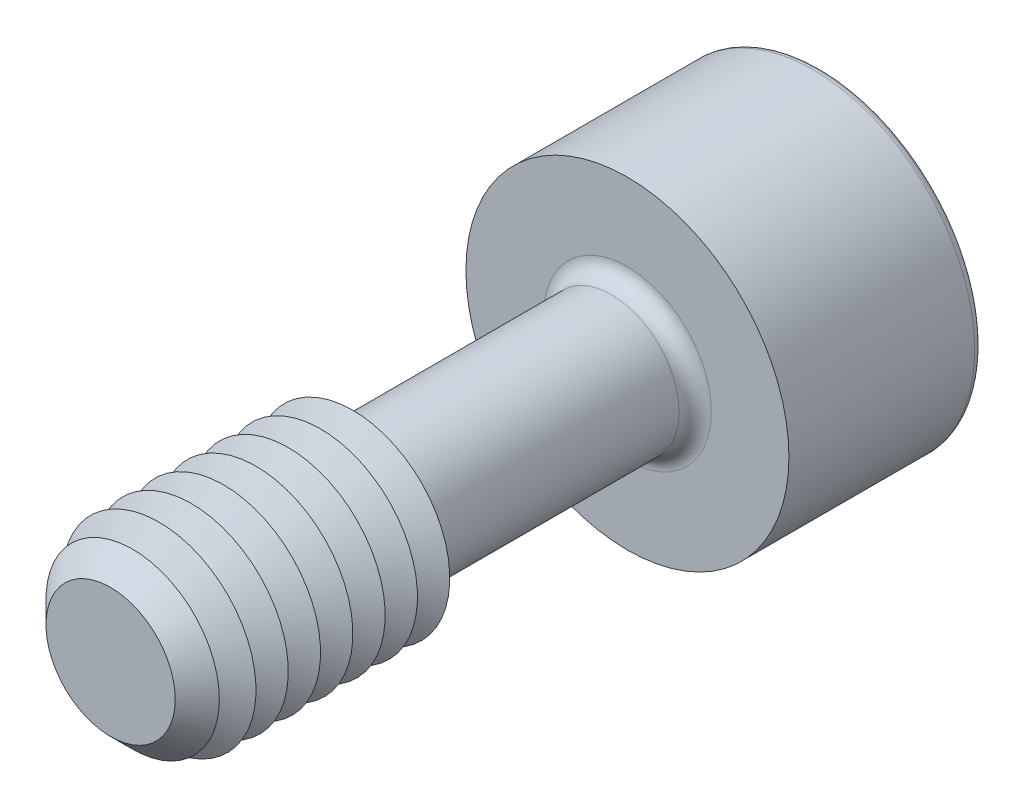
SolidWorks part; units mm, degrees
ref_plane "Front Plane" through (0, 0, 0) normal (0, 0, 1) x (1, 0, 0)
ref_plane "Top Plane" through (0, 0, 0) normal (0, 1, 0) x (1, 0, 0)
ref_plane "Right Plane" through (0, 0, 0) normal (1, 0, 0) x (0, 0, -1)
sketch "Sketch1" plane through (0, 0, 0) normal (0, 0, 1) x (1, 0, 0)
  circle A0 centre (0, 0) radius 2.1
  dimension "D1" = 4.2
extrude "Extrude1" add sketch "Sketch1" along normal mid plane 16
sketch "Sketch2" plane through (0, 0, 0) normal (1, 0, 0) x (0, 0, -1)
  line L0 (-8, 0) -> (-8, 3)
  line L1 (-8, 2.1) -> (-8, -2.1) construction
  line L2 (-8, 3) -> (-0.5, 3)
  line L3 (-0.5, 3) -> (0.0196, 2.1)
  line L4 (8, 2.1) -> (-8, 2.1) construction
  line L5 (0.0196, 2.1) -> (0.0196, 0)
  line L6 (0.0196, 0) -> (-8, 0)
  dimension "D1" = 3
  dimension "D2" = 120
  dimension "D3" = 7.5
revolve "Revolve1" add sketch "Sketch2" angle 360 about L6
chamfer "Chamfer1" distance 1 angle 45 1 edges at (0, 3, 8)
sketch "Sketch3" plane through (0, 0, -8) normal (0, 0, -1) x (-1, 0, 0)
  circle A0 centre (0, 0) radius 5
  dimension "D1" = 10
extrude "Extrude2" add sketch "Sketch3" along normal blind 6
sketch "Sketch4" plane through (-13.7, 0, -14) normal (0, 0, 1) x (1, 0, 0)
  line L2 (12.2566, -2.5) -> (15.1434, -2.5)
  line L3 (15.1434, -2.5) -> (16.5868, 0)
  line L4 (16.5868, 0) -> (15.1434, 2.5)
  line L6 (15.1434, 2.5) -> (12.2566, 2.5)
  line L7 (12.2566, 2.5) -> (10.8132, 0)
  line L8 (10.8132, 0) -> (12.2566, -2.5)
  circle A0 centre (13.7, 0) radius 2.5 construction
  dimension "D1" = 5
extrude "Extrude3" cut sketch "Sketch4" along normal blind 5
fillet "Fillet1" radius 0.5 1 edges at (-2.1, 0, -8)
fillet "Fillet2" radius 0.25 1 edges at (-5, 0, -14)
sketch "Sketch5" plane through (0, 0, 0) normal (1, 0, 0) x (0, 0, -1)
  line L0 (9, 0) -> (9, -2.5)
  line L1 (9, -2.5) -> (7.5566, 0)
  line L2 (7.5566, 0) -> (9, 0)
  dimension "D1" = 30
revolve "Cut-Revolve1" cut sketch "Sketch5" angle 360 about L2
sketch "Sketch6" plane through (0, 0, 0) normal (1, 0, 0) x (0, 0, -1)
  line L0 (1.332, 0) -> (-13.289, 0) construction
sketch "Sketch7" plane through (0, 0, 0) normal (1, 0, 0) x (0, 0, -1)
  line L0 (-0.5, 3) -> (-1, 2.134)
  line L1 (-1, 2.134) -> (-1.5, 3)
  line L2 (-0.5, 3) -> (-7, 3) construction
  line L3 (-1.5, 3) -> (-0.5, 3)
  dimension "D1" = 1
revolve "Cut-Revolve2" cut sketch "Sketch7" angle 360 about L0
pattern_linear "LPattern1" count 7 spacing 1 along (0, 0, 1) of "Cut-Revolve2"
